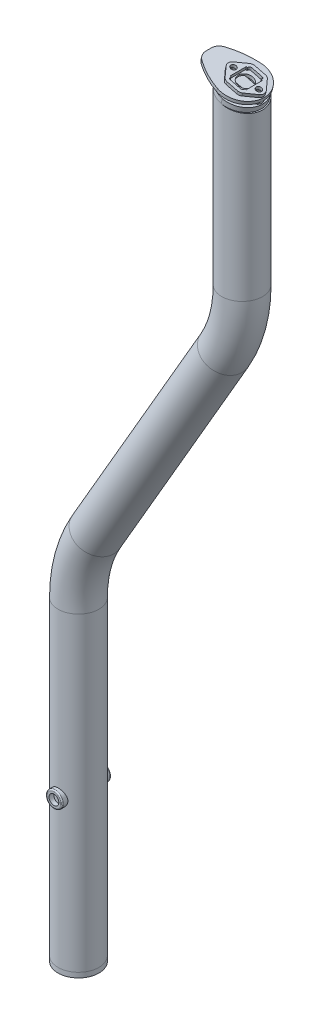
SolidWorks part; units mm, degrees
ref_plane "Plan de face" through (0, 0, 0) normal (0, 0, 1) x (1, 0, 0)
ref_plane "Plan de dessus" through (0, 0, 0) normal (0, 1, 0) x (1, 0, 0)
ref_plane "Plan de droite" through (0, 0, 0) normal (1, 0, 0) x (0, 0, -1)
sketch "Esquisse1" plane through (0, 0, 0) normal (0, 0, 1) x (1, 0, 0)
  line L0 (-12.5, 400) -> (-12.5, -90)
  line L1 (-12.5, -90) -> (-10.5, -90)
  line L2 (-10.5, -90) -> (-10.5, 400)
  line L3 (-10.5, 400) -> (-12.5, 400)
  line L4 (0, 0) -> (0, 47.5191) construction
  dimension "D1" = 12.5
  dimension "D2" = 2
  dimension "D3" = 90
  dimension "D4" = 400
revolve "Révolution1" add sketch "Esquisse1" angle 360 about L4
ref_plane "Plan1" through (0, 43, 0) normal (0, 1, 0) x (-1, 0, 0)
sketch "Esquisse20" plane through (0, 0, 0) normal (0, 1, 0) x (1, 0, 0)
  line L0 (0, 0) -> (0, 19.193) construction
  line L1 (-4.25, 15) -> (-3, 15)
  line L2 (-5, 14.25) -> (-5, -14.25)
  line L3 (-4.25, -15) -> (-3, -15)
  line L4 (-3, 15) -> (-3, -15)
  arc A0 (-5, -14.25) -> (-4.25, -15) centre (-4.25, -14.25) ccw
  arc A1 (-4.25, 15) -> (-5, 14.25) centre (-4.25, 14.25) ccw
  dimension "D5" = 0.75
  dimension "D1" = 3
  dimension "D2" = 15
  dimension "D3" = 30
  dimension "D4" = 5
revolve "Révolution5" add sketch "Esquisse20" angle 360 about L0
ref_plane "Plan2" through (0, -39.2, 0) normal (0, 1, 0) x (-1, 0, 0)
sketch "Esquisse5" plane through (0, -90, 0) normal (0, -1, 0) x (1, 0, 0)
  circle A0 centre (0, 0) radius 5
  circle A1 centre (0, 0) radius 12.5
  circle A2 centre (0, 0) radius 12.5
  dimension "D2" = 10
  dimension "D1" = 0
extrude "Boss.-Extru.4" add sketch "Esquisse5" along normal blind 3 separate body
sketch "Esquisse13" plane through (0, 0, 0) normal (0, 0, 1) x (1, 0, 0)
  line L1 (-160.188, 423.5495) -> (131.9433, 423.5495)
  line L2 (-160.188, 423.5495) -> (-160.188, 91.0686)
  line L3 (-160.188, 91.0686) -> (131.9433, 91.0686)
  line L4 (131.9433, 423.5495) -> (131.9433, 91.0686)
extrude "Enlèv. mat.-Extru.2" cut sketch "Esquisse13" against normal mid plane 150
sketch "Esquisse14" plane through (0, 0, 0) normal (0, 0, -1) x (-1, 0, 0)
  line L0 (0, 91.0686) -> (0, 99.5471)
  line L1 (12.5, 91.0686) -> (-12.5, 91.0686) construction
  line L2 (-10.7979, 139.6852) -> (-89.2021, 274.8619)
  line L3 (-100, 315) -> (-100, 420)
  arc A0 (-89.2021, 274.8619) -> (-100, 315) centre (-20, 315) cw
  arc A1 (-10.7979, 139.6852) -> (0, 99.5471) centre (-80, 99.5471) cw
  point P9 (-100, 293.4785)
  point P12 (0, 121.0686)
  dimension "D5" = 80
  dimension "D1" = 420
  dimension "D2" = 105
  dimension "D3" = 30
  dimension "D4" = 100
sketch "Esquisse15" plane through (0, 91.0686, 0) normal (0, 1, 0) x (1, 0, 0)
  circle A0 centre (0, 0) radius 10.5 construction
  circle A1 centre (0, 0) radius 12.5
  circle A2 centre (0, 0) radius 12.5
  circle A3 centre (0, 0) radius 10.5
  dimension "D1" = 0
sweep "Balayage1" add profiles "Esquisse15" path "Esquisse14"
sketch "Esquisse21" plane through (0, 0, 0) normal (0, 0, 1) x (1, 0, 0)
  line L0 (87.5, 420) -> (119.8093, 411.9444)
  line L1 (119.8093, 411.9444) -> (115.6325, 436.5152)
  line L2 (115.6325, 436.5152) -> (87.5, 420)
  line L3 (110.5, 420) -> (89.5, 420) construction
  dimension "D1" = 14
extrude "Enlèv. mat.-Extru.3" cut sketch "Esquisse21" against normal mid plane 50
sketch "Esquisse22" plane through (103.7101, 415.9584, 0) normal (0.2419, 0.9703, 0) x (0.9703, -0.2419, 0)
  line L0 (-7.5, 5.15) -> (0.5, 5.15) construction
  line L1 (-7.5, 7.65) -> (0.5, 7.65) construction
  line L2 (-7.5, 2.65) -> (0.5, 2.65) construction
  line L3 (-7.5, -5.15) -> (0.5, -5.15) construction
  line L4 (-7.5, -2.65) -> (0.5, -2.65) construction
  line L5 (-7.5, -7.65) -> (0.5, -7.65) construction
  line L6 (2.25, -2.9115) -> (2.25, -6.75)
  line L7 (-8.25, 7.75) -> (1.25, 7.75)
  line L8 (-9.25, 6.75) -> (-9.25, 2.9115)
  line L9 (-8.25, -7.75) -> (1.25, -7.75)
  line L10 (2.25, 6.75) -> (2.25, 2.9115)
  line L11 (-8.5, 5.7952) -> (-8.5, -5.15) construction
  line L12 (-9.25, -2.9115) -> (-9.25, -6.75)
  line L13 (-9.25, -2.5) -> (2.25, -2.5) construction
  arc A0 (-7.5, 7.65) -> (-7.5, 2.65) centre (-7.5, 5.15) ccw construction
  arc A1 (0.5, 2.65) -> (0.5, 7.65) centre (0.5, 5.15) ccw construction
  arc A2 (-7.5, -2.65) -> (-7.5, -7.65) centre (-7.5, -5.15) ccw construction
  arc A3 (0.5, -7.65) -> (0.5, -2.65) centre (0.5, -5.15) ccw construction
  circle A4 centre (4.5, 0) radius 1.5
  circle A5 centre (-11.5, 0) radius 1.5
  arc A6 (1.9948, 2.2442) -> (1.9948, -2.2442) centre (4.5, 0) ccw
  arc A7 (-8.9948, -2.2442) -> (-8.9948, 2.2442) centre (-11.5, 0) ccw
  arc A8 (-8.25, 7.75) -> (-9.25, 6.75) centre (-8.25, 6.75) ccw
  arc A9 (-8.9948, 2.2442) -> (-9.25, 2.9115) centre (-8.25, 2.9115) cw
  arc A10 (-8.9948, -2.2442) -> (-9.25, -2.9115) centre (-8.25, -2.9115) ccw
  arc A11 (-9.25, -6.75) -> (-8.25, -7.75) centre (-8.25, -6.75) ccw
  arc A12 (1.25, -7.75) -> (2.25, -6.75) centre (1.25, -6.75) ccw
  arc A13 (1.9948, -2.2442) -> (2.25, -2.9115) centre (1.25, -2.9115) cw
  arc A14 (1.9948, 2.2442) -> (2.25, 2.9115) centre (1.25, 2.9115) ccw
  arc A15 (1.25, 7.75) -> (2.25, 6.75) centre (1.25, 6.75) cw
  ellipse E1 centre (-3.8236, 0) end of major axis (-16.7063, 0) minor radius 12.5
  ellipse E2 centre (-3.8236, 0) end of major axis (-16.7063, 0) minor radius 12.5
  point P2 (-3.5, 5.15)
  point P7 (-3.5, -5.15)
  point P49 (2.25, -7.75)
  point P57 (2.25, 7.75)
  dimension "D2" = 3
  dimension "D3" = 3
  dimension "D4" = 2.5
  dimension "D5" = 2.5
  dimension "D18" = 1
  dimension "D1" = 16
  dimension "D6" = 8
  dimension "D7" = 8
  dimension "D8" = 4
  dimension "D9" = 4
  dimension "D10" = 10.3
  dimension "D11" = 5.15
  dimension "D12" = 4.5
  dimension "D14" = 15.5
  dimension "D15" = 11.5
  dimension "D16" = 7.75
  dimension "D17" = 5.75
  dimension "D19" = 2.5
  dimension "D20" = 5
  dimension "D13" = 0
extrude "Boss.-Extru.7" add sketch "Esquisse22" along normal blind 3 separate body
sketch "Esquisse23" plane through (0, 0, 0) normal (0, 0, 1) x (1, 0, 0)
  line L0 (113.0162, 418.9148) -> (79.0558, 427.3821)
  line L1 (79.0558, 427.3821) -> (79.5396, 429.3227)
  line L2 (79.5396, 429.3227) -> (113.5, 420.8554)
  line L3 (113.5, 420.8554) -> (113.0162, 418.9148)
  line L4 (113.2258, 416.6777) -> (88.2258, 422.9109) construction
  line L5 (112.5, 315) -> (112.5, 413.7668) construction
  dimension "D1" = 2.12
  dimension "D2" = 2
  dimension "D3" = 1
  dimension "D4" = 35
extrude "Boss.-Extru.8" add sketch "Esquisse23" along normal mid plane 50 separate body
sketch "Esquisse24" plane through (105.4326, 422.8669, 0) normal (0.2419, 0.9703, 0) x (0.9703, -0.2419, 0)
  line L0 (-11.5, 0) -> (4.5, 0) construction
  line L1 (8.3144, 0) -> (4.5, 0) construction
  line L3 (-26.6856, -25) -> (-26.6856, 25) construction
  line L4 (-26.6856, 1.5849) -> (-26.6856, -1.5849)
  line L5 (8.3144, -25) -> (8.3144, 25) construction
  line L7 (-55.2639, 39.5271) -> (31.9315, 39.5271)
  line L8 (-55.2639, 39.5271) -> (-55.2639, -49.8189)
  line L9 (-55.2639, -49.8189) -> (31.9315, -49.8189)
  line L10 (31.9315, 39.5271) -> (31.9315, -49.8189)
  circle A0 centre (4.5, 0) radius 1.5 construction
  circle A1 centre (4.5, 0) radius 1.5
  circle A2 centre (-11.5, 0) radius 1.5 construction
  circle A3 centre (-11.5, 0) radius 1.5
  circle A4 centre (-3.5, 0) radius 4.5
  arc A5 (-7.5307, -13.2948) -> (-7.5307, 13.2948) centre (-5.1856, 0) ccw
  arc A6 (-7.5307, 13.2948) -> (-23.6419, 7.0899) centre (0.2863, -31.0211) ccw
  arc A7 (-23.6419, 7.0899) -> (-26.6856, 1.5849) centre (-20.1856, 1.5849) ccw
  arc A8 (-7.5307, -13.2948) -> (-23.6419, -7.0899) centre (0.2863, 31.0211) cw
  arc A9 (-23.6419, -7.0899) -> (-26.6856, -1.5849) centre (-20.1856, -1.5849) cw
  point P22 (-26.6856, 5)
  point P28 (-26.6856, 0)
  dimension "D1" = 9
  dimension "D2" = 13.5
  dimension "D4" = 45
  dimension "D5" = 6.5
  dimension "D3" = 5
extrude "Enlèv. mat.-Extru.4" cut sketch "Esquisse24" against normal blind 50 contours A7 A6 A5 M4 M1 M2 | A8 A9 A5 M2 M3 M4 | A4 | A3 | A1
sketch "Esquisse27" plane through (0, 0, 0) normal (0, 0, 1) x (1, 0, 0)
  line L0 (112.5, 315) -> (112.5, 413.7668) construction
  line L1 (112.5, 397.7071) -> (121.3031, 397.7071)
  line L2 (112.5, 397.7071) -> (112.5, 429.5111)
  line L3 (112.5, 429.5111) -> (121.3031, 429.5111)
  line L4 (121.3031, 397.7071) -> (121.3031, 429.5111)
  line L5 (100, 416.8834) -> (100, 396.7219) construction
  line L6 (112.5, 413.7668) -> (87.5, 420) construction
revolve "Enlèvement de matière-Révolution2" cut sketch "Esquisse27" angle 360 about L5
sketch "Esquisse28" plane through (104.4358, 418.8693, 0) normal (0.2419, 0.9703, 0) x (0.9703, -0.2419, 0)
  circle A0 centre (-21.4561, 16.1062) radius 44.1808
  ellipse E2 centre (-3.8236, 0) end of major axis (-16.7063, 0) minor radius 12.5 (-4.1976, 12.4947) -> (-4.1976, -12.4947) ccw
  ellipse E3 centre (-4.5716, 0) end of major axis (-17.4543, 0) minor radius 12.5 (-4.1976, -12.4947) -> (-4.1976, 12.4947) ccw
  ellipse E4 centre (-3.8236, 0) end of major axis (-16.7063, 0) minor radius 12.5 (-4.1976, 12.4947) -> (-4.1976, -12.4947) ccw
  ellipse E5 centre (-4.5716, 0) end of major axis (-17.4543, 0) minor radius 12.5 (-4.1976, -12.4947) -> (-4.1976, 12.4947) ccw
  dimension "D1" = 0
extrude "Enlèv. mat.-Extru.5" cut sketch "Esquisse28" against normal blind 10
sketch "Esquisse36" plane through (104.4358, 418.8693, 0) normal (0.2419, 0.9703, 0) x (0.9703, -0.2419, 0)
  line L3 (-7.5, -5.15) -> (0.5, -5.15) construction
  line L4 (2.25, -2.9115) -> (2.25, -6.75) construction
  line L5 (0.75, -3.1) -> (-7.75, -3.1)
  line L7 (1.55, 5) -> (1.55, -5) construction
  line L8 (1.55, -5) -> (0.85, -5) construction
  line L9 (0.85, -5) -> (0.85, -5.5) construction
  line L10 (-0.15, -6.5) -> (-5.8366, -6.5) construction
  line L11 (-6.378, -8.5) -> (-0.15, -8.5) construction
  line L12 (2.0723, -7.5152) -> (6.9075, -2.1832) construction
  line L13 (2.25, -6) -> (3.1283, -6)
  line L14 (6.9075, -2.1832) -> (3.6601, -5.7644)
  line L15 (2.25, -4.6) -> (2.25, -6)
  line L16 (4.5, 0) -> (-3.5, 0) construction
  line L17 (-3.5, 0) -> (-3.5, -5.15) construction
  line L18 (-13.9075, -2.1832) -> (-10.6601, -5.7644)
  line L19 (-7.85, -5) -> (-7.85, -5.5) construction
  line L20 (-8.55, -5) -> (-7.85, -5) construction
  line L21 (-9.25, -4.6) -> (-9.25, -6)
  line L22 (-9.25, -6) -> (-10.1283, -6)
  line L23 (-8.55, 5) -> (-7.85, 5) construction
  line L24 (-7.85, 5) -> (-7.85, 5.5) construction
  line L27 (-7.5, 5.15) -> (0.5, 5.15) construction
  line L28 (-9.25, 6) -> (-10.1283, 6)
  line L29 (-9.25, 4.6) -> (-9.25, 6)
  line L30 (-13.9075, 2.1832) -> (-10.6601, 5.7644)
  line L31 (2.25, 4.6) -> (2.25, 6)
  line L32 (6.9075, 2.1832) -> (3.6601, 5.7644)
  line L33 (2.25, 6) -> (3.1283, 6)
  line L34 (0.75, 3.1) -> (-7.75, 3.1)
  circle A0 centre (4.5, 0) radius 1.65
  circle A1 centre (-11.5, 0) radius 1.65
  arc A4 (2.25, -4.6) -> (0.75, -3.1) centre (0.75, -4.6) ccw
  arc A5 (-10.1283, -6) -> (-10.6601, -5.7644) centre (-10.1283, -5.2821) cw
  arc A8 (6.9075, -2.1832) -> (6.9075, 2.1832) centre (4.5, 0) ccw
  arc A9 (-13.9075, 2.1832) -> (-13.9075, -2.1832) centre (-11.5, 0) ccw
  arc A10 (-0.15, -8.5) -> (2.0723, -7.5152) centre (-0.15, -5.5) ccw construction
  arc A11 (0.85, -5.5) -> (-0.15, -6.5) centre (-0.15, -5.5) cw construction
  arc A12 (3.1283, -6) -> (3.6601, -5.7644) centre (3.1283, -5.2821) ccw
  arc A13 (-9.25, -4.6) -> (-7.75, -3.1) centre (-7.75, -4.6) cw
  arc A14 (-9.25, 4.6) -> (-7.75, 3.1) centre (-7.75, 4.6) ccw
  arc A15 (3.1283, 6) -> (3.6601, 5.7644) centre (3.1283, 5.2821) cw
  arc A16 (-10.1283, 6) -> (-10.6601, 5.7644) centre (-10.1283, 5.2821) ccw
  arc A17 (2.25, 4.6) -> (0.75, 3.1) centre (0.75, 4.6) cw
  point P15 (-3.5, -5.15)
  dimension "D1" = 3.3
  dimension "D2" = 3.3
  dimension "D3" = 6.5
  dimension "D4" = 5.05
  dimension "D12" = 3
  dimension "D13" = 1
  dimension "D14" = 0.7179
  dimension "D16" = 1.5
  dimension "D5" = 3.1
  dimension "D7" = 0.7
  dimension "D8" = 0.7
  dimension "D9" = 6.5
  dimension "D10" = 5
  dimension "D11" = 2
  dimension "D15" = 6
extrude "Boss.-Extru.16" add sketch "Esquisse36" along normal blind 3 separate body
sketch "Esquisse37" plane through (105.1616, 421.7801, 0) normal (0.2419, 0.9703, 0) x (0.9703, -0.2419, 0)
  line L0 (2.0723, -7.5152) -> (6.9075, -2.1832) construction
  line L1 (-6.378, -8.5) -> (-0.15, -8.5) construction
  line L2 (-0.15, -6.5) -> (-5.8366, -6.5) construction
  line L3 (0.85, -5) -> (0.85, -5.5) construction
  line L4 (1.55, -5) -> (0.85, -5) construction
  line L5 (1.55, 5) -> (1.55, -5) construction
  line L6 (2.0723, -7.5152) -> (6.9075, -2.1832)
  line L7 (-6.85, -8.5) -> (-0.15, -8.5)
  line L8 (-0.15, -6.5) -> (-6.85, -6.5)
  line L9 (0.85, -5) -> (0.85, -5.5)
  line L10 (1.55, -5) -> (0.85, -5)
  line L11 (1.55, 5) -> (1.55, -5)
  line L12 (4.5, 0) -> (-3.5, 0) construction
  line L13 (-3.5, 5.15) -> (-3.5, -5.15) construction
  line L14 (-8.55, 5) -> (-8.55, -5)
  line L15 (-9.0723, -7.5152) -> (-13.9075, -2.1832)
  line L16 (-8.55, -5) -> (-7.85, -5)
  line L17 (-7.85, -5) -> (-7.85, -5.5)
  line L18 (-7.85, 5) -> (-7.85, 5.5)
  line L19 (-8.55, 5) -> (-7.85, 5)
  line L20 (-9.0723, 7.5152) -> (-13.9075, 2.1832)
  line L21 (1.55, 5) -> (0.85, 5)
  line L22 (0.85, 5) -> (0.85, 5.5)
  line L23 (-0.15, 6.5) -> (-6.85, 6.5)
  line L24 (-6.85, 8.5) -> (-0.15, 8.5)
  line L25 (2.0723, 7.5152) -> (6.9075, 2.1832)
  arc A0 (6.9075, -2.1832) -> (6.9075, 2.1832) centre (4.5, 0) ccw construction
  circle A1 centre (4.5, 0) radius 1.65 construction
  arc A2 (-0.15, -8.5) -> (2.0723, -7.5152) centre (-0.15, -5.5) ccw construction
  arc A3 (-0.15, -6.5) -> (0.85, -5.5) centre (-0.15, -5.5) ccw construction
  arc A4 (6.9075, -2.1832) -> (6.9075, 2.1832) centre (4.5, 0) ccw
  circle A5 centre (4.5, 0) radius 1.65
  arc A6 (-0.15, -8.5) -> (2.0723, -7.5152) centre (-0.15, -5.5) ccw
  arc A7 (-0.15, -6.5) -> (0.85, -5.5) centre (-0.15, -5.5) ccw
  arc A8 (-13.9075, -2.1832) -> (-13.9075, 2.1832) centre (-11.5, 0) cw
  arc A9 (-6.85, -6.5) -> (-7.85, -5.5) centre (-6.85, -5.5) cw
  arc A10 (-6.85, -8.5) -> (-9.0723, -7.5152) centre (-6.85, -5.5) cw
  circle A11 centre (-11.5, 0) radius 1.65 construction
  circle A12 centre (-11.5, 0) radius 1.65
  arc A13 (-6.85, 8.5) -> (-9.0723, 7.5152) centre (-6.85, 5.5) ccw
  arc A14 (-6.85, 6.5) -> (-7.85, 5.5) centre (-6.85, 5.5) ccw
  arc A15 (-0.15, 6.5) -> (0.85, 5.5) centre (-0.15, 5.5) cw
  arc A16 (-0.15, 8.5) -> (2.0723, 7.5152) centre (-0.15, 5.5) cw
extrude "Boss.-Extru.17" add sketch "Esquisse37" along normal blind 3 separate body
